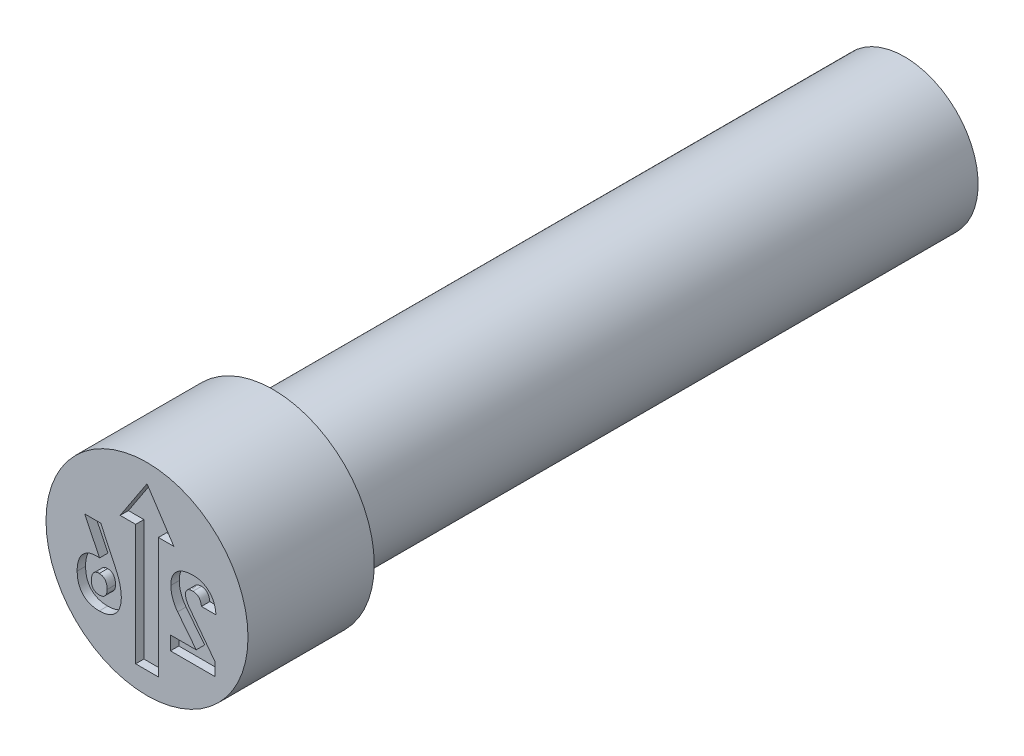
SolidWorks part; units mm, degrees
ref_plane "Front Plane" through (0, 0, 0) normal (0, 0, 1) x (1, 0, 0)
ref_plane "Top Plane" through (0, 0, 0) normal (0, 1, 0) x (1, 0, 0)
ref_plane "Right Plane" through (0, 0, 0) normal (1, 0, 0) x (0, 0, -1)
imported_body "Imported1"
sketch "Sketch1" plane through (0, 0, -0.4267) normal (0, 0, 1) x (1, 0, 0)
  line L7 (0.6385, 0.9906) -> (0, 1.9597)
  line L8 (0, 1.9597) -> (-0.6385, 0.9906)
  line L9 (-0.6385, 0.9906) -> (-0.27, 0.9906)
  line L10 (-0.27, 0.9906) -> (-0.27, -1.88)
  line L11 (-0.27, -1.88) -> (0.27, -1.88)
  line L12 (0.27, -1.88) -> (0.27, 0.9906)
  line L13 (0.27, 0.9906) -> (0.6385, 0.9906)
  line L14 (0.6385, 0.9906) -> (0, 1.9597)
  line L15 (0, 1.9597) -> (-0.6385, 0.9906)
  line L16 (-0.6385, 0.9906) -> (-0.27, 0.9906)
  line L17 (-0.27, 0.9906) -> (-0.27, -1.88)
  line L18 (-0.27, -1.88) -> (0.27, -1.88)
  line L19 (0.27, -1.88) -> (0.27, 0.9906)
  line L20 (0.27, 0.9906) -> (0.6385, 0.9906)
  dimension "D1" = 0
extrude "Boss-Extrude1" add sketch "Sketch1" along normal blind 0.23
sketch "Sketch2" plane through (0, 0, 0) normal (0, 0, 1) x (1, 0, 0)
  text T0 "2  6" font "Bahnschrift" height 1.8
  dimension "D1" = 1.75
  dimension "D2" = 1.2
extrude "Cut-Extrude1" cut sketch "Sketch2" against normal blind 0.2
